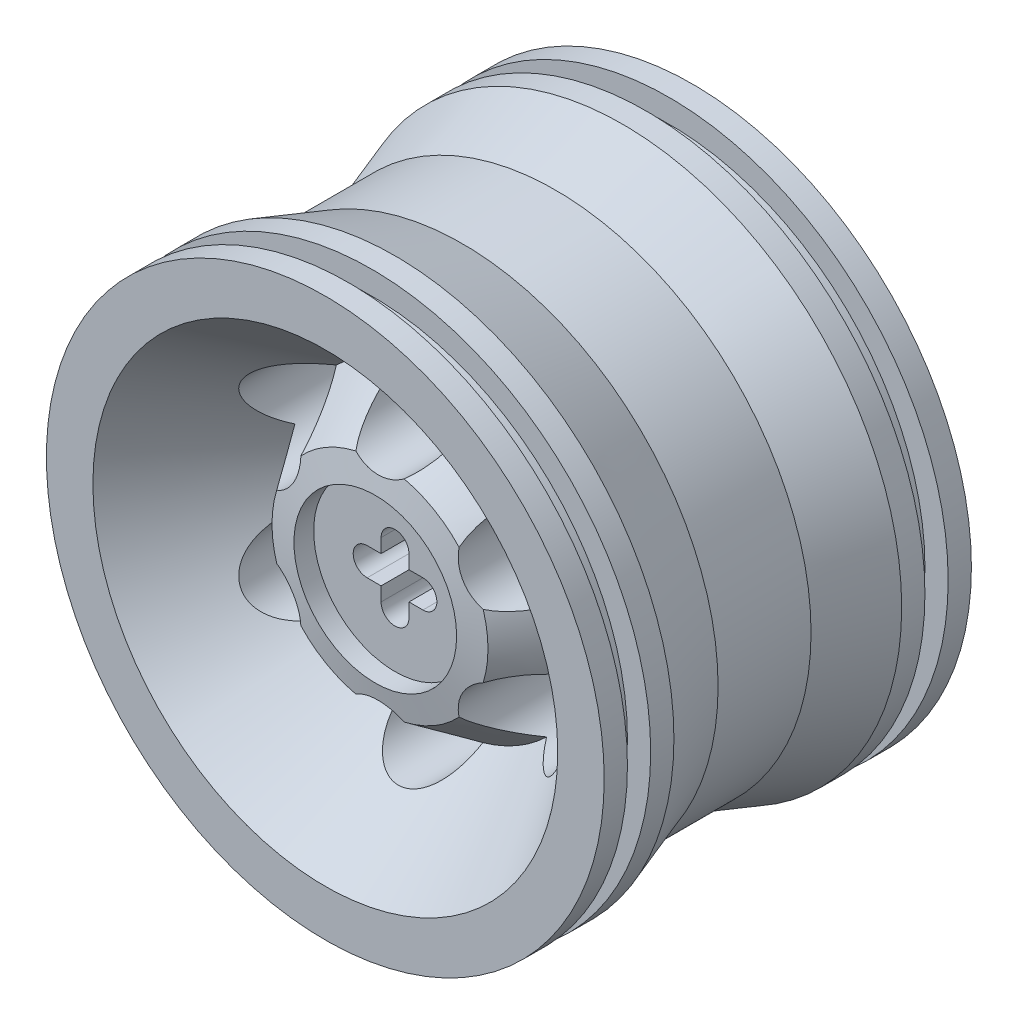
SolidWorks part; units mm, degrees
ref_plane "Front Plane" through (0, 0, 0) normal (0, 0, 1) x (1, 0, 0)
ref_plane "Top Plane" through (0, 0, 0) normal (0, 1, 0) x (1, 0, 0)
ref_plane "Right Plane" through (0, 0, 0) normal (1, 0, 0) x (0, 0, -1)
sketch "Sketch1" plane through (0, 0, 0) normal (0, 1, 0) x (1, 0, 0)
  line L0 (-7.62, 3.81) -> (0, 3.81)
  line L1 (-7.62, -3.81) -> (0, -3.81)
  circle A0 centre (0, 0) radius 2.286 construction
  arc A1 (0, -3.81) -> (0, 3.81) centre (0, 0) ccw
  arc A2 (-7.62, 3.81) -> (-7.62, -3.81) centre (-7.62, 0) ccw
  dimension "D1" = 7.62
  dimension "D2" = 4.572
  dimension "D3" = 7.62
extrude "Extrude1" add sketch "Sketch1" along normal blind 3.81
ref_plane "Plane1" through (0, 0, 3.81) normal (0, 0, 1) x (1, 0, 0)
sketch "Sketch4" plane through (0, 0, 3.81) normal (0, 0, 1) x (1, 0, 0)
  line L0 (0, 0) -> (0, 3.81)
  line L2 (0, 3.81) -> (7.62, 3.81)
  line L4 (7.62, 0) -> (0, 0)
  line L5 (7.62, 0) -> (11.43, 0)
  arc A0 (11.43, 0) -> (7.62, 3.81) centre (7.62, 0) ccw
  dimension "D2" = 3.81
  dimension "D1" = 7.62
extrude "Extrude2" add sketch "Sketch4" against normal blind 0.508
sketch "Sketch6" plane through (0, 0, 3.81) normal (0, 0, 1) x (1, 0, 0)
  line L0 (6.858, 2.032) -> (6.858, 1.016)
  line L1 (6.604, 0.762) -> (5.588, 0.762)
  line L2 (5.334, 0.508) -> (5.334, -0.508)
  line L3 (5.588, -0.762) -> (6.604, -0.762)
  line L4 (6.858, -1.016) -> (6.858, -2.032)
  line L5 (7.112, -2.286) -> (8.128, -2.286)
  line L6 (8.382, -2.032) -> (8.382, -1.016)
  line L7 (8.636, -0.762) -> (9.652, -0.762)
  line L8 (9.906, -0.508) -> (9.906, 0.508)
  line L9 (9.652, 0.762) -> (8.636, 0.762)
  line L10 (8.382, 1.016) -> (8.382, 2.032)
  line L11 (8.128, 2.286) -> (7.112, 2.286)
  line L12 (7.62, 1.454) -> (7.62, -1.454) construction
  line L13 (3.4212, 0) -> (11.8188, 0) construction
  arc A0 (6.858, 1.016) -> (6.604, 0.762) centre (6.604, 1.016) cw
  arc A1 (6.858, 2.032) -> (7.112, 2.286) centre (7.112, 2.032) cw
  arc A2 (8.128, 2.286) -> (8.382, 2.032) centre (8.128, 2.032) cw
  arc A3 (8.382, 1.016) -> (8.636, 0.762) centre (8.636, 1.016) ccw
  arc A4 (9.652, 0.762) -> (9.906, 0.508) centre (9.652, 0.508) cw
  arc A5 (9.652, -0.762) -> (9.906, -0.508) centre (9.652, -0.508) ccw
  arc A6 (8.636, -0.762) -> (8.382, -1.016) centre (8.636, -1.016) ccw
  arc A7 (8.382, -2.032) -> (8.128, -2.286) centre (8.128, -2.032) cw
  arc A8 (7.112, -2.286) -> (6.858, -2.032) centre (7.112, -2.032) cw
  arc A9 (6.604, -0.762) -> (6.858, -1.016) centre (6.604, -1.016) cw
  arc A10 (5.588, -0.762) -> (5.334, -0.508) centre (5.588, -0.508) cw
  arc A11 (5.334, 0.508) -> (5.588, 0.762) centre (5.588, 0.508) cw
  arc A13 (11.43, 0) -> (7.62, 3.81) centre (7.62, 0) ccw construction
  point P40 (7.62, 0)
  dimension "D6" = 0.254
  dimension "D1" = 4.572
  dimension "D2" = 4.572
  dimension "D3" = 1.524
  dimension "D4" = 1.524
  dimension "D5" = 1.524
extrude "Cut-Extrude2" cut sketch "Sketch6" against normal through all
sketch "Sketch8" plane through (0, 0, 3.302) normal (0, 0, -1) x (-1, 0, 0)
  line L0 (-10.795, 0) -> (-10.414, 0)
  line L1 (-4.826, 0) -> (-4.445, 0)
  line L2 (-7.62, 0) -> (-7.62, 5.3462) construction
  line L4 (-8.001, 2.7679) -> (-8.001, 3.1521)
  line L6 (-7.239, 2.7679) -> (-7.239, 3.1521)
  arc A0 (-4.445, 0) -> (-7.239, 3.1521) centre (-7.62, 0) ccw
  arc A1 (-4.826, 0) -> (-7.239, 2.7679) centre (-7.62, 0) ccw
  arc A2 (-8.001, 3.1521) -> (-10.795, 0) centre (-7.62, 0) ccw
  arc A3 (-8.001, 2.7679) -> (-10.414, 0) centre (-7.62, 0) ccw
  dimension "D1" = 5.588
  dimension "D2" = 6.35
  dimension "D3" = 0.762
extrude "Extrude3" add sketch "Sketch8" along normal blind 3.302
sketch "Sketch9" plane through (0, 0, 0) normal (0, 0, -1) x (-1, 0, 0)
  line L0 (-4.826, 0) -> (-4.445, 0) construction
  line L2 (-4.6355, 0) -> (-1.0818, 0)
  line L3 (-4.6355, 0) -> (-4.6355, 0.1905)
  line L4 (-4.6355, 0.1905) -> (-1.0818, 0.1905)
  line L5 (-1.0818, 0) -> (-1.0818, 0.1905)
  dimension "D1" = 0.1905
extrude "Extrude4" add sketch "Sketch9" against normal through all
mirror "Mirror5" about plane through (7.62, 0, 0) normal (0, 0, -1) of "Cut-Extrude2", "Extrude3", "Extrude2", "Extrude4"
sketch "Sketch11" plane through (0, 3.81, 0) normal (0, 1, 0) x (1, 0, 0)
  circle A0 centre (0, 0) radius 2.286
  circle A1 centre (-7.62, 0) radius 2.286
  arc A2 (-7.62, 3.81) -> (-7.62, -3.81) centre (-7.62, 0) ccw construction
  dimension "D1" = 4.572
extrude "Cut-Extrude3" cut sketch "Sketch11" against normal through all
sketch "Sketch12" plane through (0, 3.81, 0) normal (0, 1, 0) x (1, 0, 0)
  circle A0 centre (0, 0) radius 3.175
  circle A1 centre (-7.62, 0) radius 3.175
  dimension "D1" = 6.35
extrude "Cut-Extrude4" cut sketch "Sketch12" against normal blind 0.508
mirror "Mirror6"
sketch "Sketch13" plane through (0, 0, 3.81) normal (0, 0, 1) x (1, 0, 0)
  circle A0 centre (7.62, 0) radius 3.81
extrude "Cut-Extrude5" cut sketch "Sketch13" against normal through all flip side to cut
sketch "Sketch15" plane through (0, 0, -3.302) normal (0, 0, 1) x (1, 0, 0)
  line L1 (4.486, 2.1667) -> (5.2992, 2.1667)
  line L3 (4.492, -2.1753) -> (5.3073, -2.1753)
  arc A0 (4.486, 2.1667) -> (4.492, -2.1753) centre (7.62, 0) ccw
  arc A1 (5.2992, 2.1667) -> (5.3073, -2.1753) centre (7.62, 0) ccw
extrude "Cut-Extrude7" cut sketch "Sketch15" along normal up to surface (6.604 mm away)
scale "Scale1" scale about origin uniform scaling no x scale factor 1 y scale factor 1 z scale factor 2.633333
sketch "Sketch18" plane through (0, 0, -10.033) normal (0, 0, -1) x (-1, 0, 0)
  line L0 (-7.62, 2.286) -> (-7.62, -2.286) construction
  line L1 (-8.128, 2.286) -> (-7.112, 2.286) construction
  line L2 (-8.128, -2.286) -> (-7.112, -2.286) construction
  point P6 (-7.62, 0)
sketch "Sketch17" plane through (0, 0, 0) normal (0, 1, 0) x (1, 0, 0)
  line L0 (10.414, 10.033) -> (10.414, -10.033)
  line L1 (10.414, -10.033) -> (22.86, -10.033)
  line L2 (22.86, 10.033) -> (22.86, 8.763)
  line L3 (22.86, 8.763) -> (21.59, 8.763)
  line L4 (22.86, 10.033) -> (10.414, 10.033)
  line L5 (0, 0) -> (22.5835, 0) construction
  line L6 (21.59, 8.763) -> (21.59, 7.493)
  line L7 (21.59, 7.493) -> (22.86, 7.493)
  line L8 (22.86, 7.493) -> (22.86, 6.223)
  line L9 (22.86, 6.223) -> (21.59, 2.54)
  line L10 (21.59, 2.54) -> (21.59, -2.54)
  line L11 (22.86, -6.223) -> (21.59, -2.54)
  line L12 (22.86, -6.223) -> (22.86, -7.493)
  line L13 (22.86, -7.493) -> (21.59, -7.493)
  line L14 (21.59, -7.493) -> (21.59, -8.763)
  line L15 (21.59, -8.763) -> (22.86, -8.763)
  line L16 (22.86, -8.763) -> (22.86, -10.033)
  line L17 (7.62, 0) -> (7.62, 13.8284) construction
  dimension "D1" = 20.066
  dimension "D2" = 1.27
  dimension "D3" = 1.27
  dimension "D4" = 1.27
  dimension "D5" = 5.08
  dimension "D6" = 1.27
  dimension "D7" = 15.24
  dimension "D8" = 12.446
revolve "Revolve1" add sketch "Sketch17" angle 360 about L17
sketch "Sketch20" plane through (0, 0, 0) normal (0, 0, 1) x (1, 0, 0)
  line L0 (7.62, 0) -> (7.62, 15.2143) construction
  circle A0 centre (7.62, 7.62) radius 2.286
  circle A1 centre (7.62, 0) radius 7.62 construction
  circle A2 centre (14.2191, 3.81) radius 2.286
  circle A3 centre (14.2191, -3.81) radius 2.286
  circle A4 centre (7.62, -7.62) radius 2.286
  circle A5 centre (1.0209, -3.81) radius 2.286
  circle A6 centre (1.0209, 3.81) radius 2.286
  dimension "D1" = 15.24
  dimension "D2" = 4.572
extrude "Extrude6" cut sketch "Sketch20" against normal through all and the other way through all
sketch "Sketch21" plane through (0, 0, 10.033) normal (0, 0, 1) x (1, 0, 0)
  circle A0 centre (7.62, 0) radius 12.7
  circle A2 centre (7.62, 0) radius 3.81
  dimension "D1" = 7.62
  dimension "D2" = 25.4
extrude "Extrude7" cut sketch "Sketch21" against normal blind 10.16 draft 35
mirror "Mirror7" about plane through (0, 0, 0) normal (0, 0, 1) of "Extrude7"
sketch "Sketch22" [suppressed] plane through (0, 0, 0) normal (0, 1, 0) x (1, 0, 0)
  line L0 (22.86, -8.763) -> (22.86, -10.033) construction
  line L1 (21.59, -8.763) -> (22.86, -8.763) construction
  line L2 (21.59, -7.493) -> (21.59, -8.763) construction
  line L3 (22.86, -7.493) -> (21.59, -7.493) construction
  line L4 (22.86, -6.223) -> (22.86, -7.493) construction
  line L5 (22.86, -6.223) -> (21.59, -2.54) construction
  line L6 (21.59, 2.54) -> (21.59, -2.54) construction
  line L7 (22.86, 6.223) -> (21.59, 2.54) construction
  line L8 (22.86, 7.493) -> (22.86, 6.223) construction
  line L9 (21.59, 7.493) -> (22.86, 7.493) construction
  line L10 (21.59, 8.763) -> (21.59, 7.493) construction
  line L11 (22.86, 8.763) -> (21.59, 8.763) construction
  line L12 (22.86, 10.033) -> (22.86, 8.763) construction
  line L13 (22.86, -8.763) -> (22.86, -10.033)
  line L14 (21.59, -8.763) -> (22.86, -8.763)
  line L15 (21.59, -7.493) -> (21.59, -8.763)
  line L16 (22.86, -7.493) -> (21.59, -7.493)
  line L17 (22.86, -6.223) -> (22.86, -7.493)
  line L18 (22.86, -6.223) -> (21.59, -2.54)
  line L19 (21.59, 2.54) -> (21.59, -2.54)
  line L20 (22.86, 6.223) -> (21.59, 2.54)
  line L21 (22.86, 7.493) -> (22.86, 6.223)
  line L22 (21.59, 7.493) -> (22.86, 7.493)
  line L23 (21.59, 8.763) -> (21.59, 7.493)
  line L24 (22.86, 8.763) -> (21.59, 8.763)
  line L25 (22.86, 10.033) -> (22.86, 8.763)
  line L26 (0, 0) -> (22.5835, 0) construction
  line L27 (0, 0) -> (22.5835, 0) construction
  line L28 (22.86, 10.033) -> (25.527, 12.7)
  line L29 (25.527, 12.7) -> (28.067, 12.7)
  line L30 (28.067, 12.7) -> (31.1785, 9.5885)
  line L31 (31.1785, 9.5885) -> (31.1785, 8.1915)
  line L32 (31.1785, 8.1915) -> (32.4485, 8.1915)
  line L33 (32.4485, 8.1915) -> (35.56, 5.08)
  line L34 (35.56, 5.08) -> (35.56, -5.08)
  line L35 (35.56, -5.08) -> (32.4485, -8.1915)
  line L36 (32.4485, -8.1915) -> (31.1785, -8.1915)
  line L37 (31.1785, -8.1915) -> (31.1785, -9.5885)
  line L38 (31.1785, -9.5885) -> (28.067, -12.7)
  line L39 (28.067, -12.7) -> (25.527, -12.7)
  line L40 (25.527, -12.7) -> (22.86, -10.033)
  line L41 (7.62, 0) -> (7.62, 13.8284) construction
  dimension "D1" = 27.94
  dimension "D2" = 25.4
  dimension "D3" = 135
  dimension "D4" = 10.16
  dimension "D5" = 1.27
  dimension "D6" = 2.54
sketch "Sketch23" plane through (0, 0, 10.033) normal (0, 0, 1) x (1, 0, 0)
  circle A1 centre (7.62, 0) radius 4.445
  dimension "D1" = 8.89
extrude "Extrude8" cut sketch "Sketch23" against normal blind 3.81
sketch "Sketch24" plane through (0, 0, -10.033) normal (0, 0, -1) x (-1, 0, 0)
  line L0 (-7.62, 2.286) -> (-7.62, -2.286) construction
  circle A0 centre (-7.62, 0) radius 4.445
  circle A1 centre (-7.62, 0) radius 4.445 construction
extrude "Extrude9" cut sketch "Sketch24" against normal blind 3.81
sketch "Sketch25" plane through (0, 0, 6.223) normal (0, 0, 1) x (1, 0, 0)
  line L12 (6.096, 0) -> (9.144, 0) construction
  line L13 (6.096, 0.762) -> (9.144, 0.762)
  line L14 (6.096, -0.762) -> (9.144, -0.762)
  line L15 (7.62, 1.524) -> (7.62, -1.524) construction
  line L16 (8.382, 1.524) -> (8.382, -1.524)
  line L17 (6.858, 1.524) -> (6.858, -1.524)
  circle A1 centre (7.62, 0) radius 4.445
  circle A2 centre (7.62, 0) radius 4.445
  arc A14 (6.096, 0.762) -> (6.096, -0.762) centre (6.096, 0) ccw
  arc A15 (9.144, -0.762) -> (9.144, 0.762) centre (9.144, 0) ccw
  arc A16 (8.382, 1.524) -> (6.858, 1.524) centre (7.62, 1.524) ccw
  arc A17 (6.858, -1.524) -> (8.382, -1.524) centre (7.62, -1.524) ccw
  point P5 (7.62, 0)
  point P12 (7.62, 0)
  dimension "D2" = 1.524
  dimension "D3" = 1.524
  dimension "D1" = 0
extrude "Extrude10" add sketch "Sketch25" against normal blind 3.81 contours A17 L17 L14 A14 L13 A16 L16 A15 M3 | M2 M3
sketch "Sketch26" plane through (0, 0, -6.223) normal (0, 0, -1) x (-1, 0, 0)
  line L12 (-9.144, 0) -> (-6.096, 0) construction
  line L13 (-9.144, 0.762) -> (-6.096, 0.762)
  line L14 (-9.144, -0.762) -> (-6.096, -0.762)
  line L15 (-7.62, 1.524) -> (-7.62, -1.524) construction
  line L16 (-6.858, 1.524) -> (-6.858, -1.524)
  line L17 (-8.382, 1.524) -> (-8.382, -1.524)
  circle A1 centre (-7.62, 0) radius 4.445
  circle A2 centre (-7.62, 0) radius 4.445
  arc A14 (-9.144, 0.762) -> (-9.144, -0.762) centre (-9.144, 0) ccw
  arc A15 (-6.096, -0.762) -> (-6.096, 0.762) centre (-6.096, 0) ccw
  arc A16 (-6.858, 1.524) -> (-8.382, 1.524) centre (-7.62, 1.524) ccw
  arc A17 (-8.382, -1.524) -> (-6.858, -1.524) centre (-7.62, -1.524) ccw
  point P5 (-7.62, 0)
  point P12 (-7.62, 0)
  dimension "D2" = 1.524
  dimension "D3" = 1.524
  dimension "D1" = 0
extrude "Extrude11" add sketch "Sketch26" against normal blind 3.81 contours M2 M3 | A17 L17 L14 A14 L13 A16 L16 A15 M3
chamfer "Chamfer1" distance 2.54 angle 45 2 edges at (12.065, 0, -9.1261) (3.175, 0, 9.1261)
